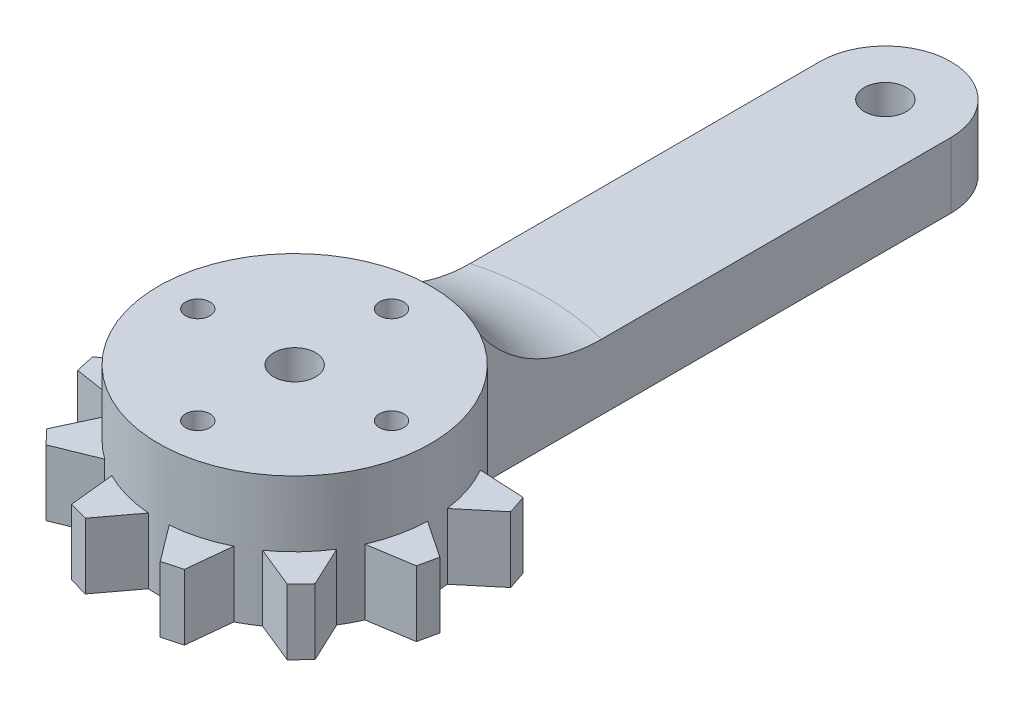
SolidWorks part; units mm, degrees
ref_plane "Front Plane" through (0, 0, 0) normal (0, 0, 1) x (1, 0, 0)
ref_plane "Top Plane" through (0, 0, 0) normal (0, 1, 0) x (1, 0, 0)
ref_plane "Right Plane" through (0, 0, 0) normal (1, 0, 0) x (0, 0, -1)
sketch "Sketch1" plane through (0, 0, 0) normal (0, 1, 0) x (1, 0, 0)
  line L0 (0, 0) -> (0, 45) construction
  line L1 (-5, 0) -> (-5, 45)
  line L2 (5, 0) -> (5, 45)
  circle A0 centre (0, 0) radius 10.38
  arc A1 (-5, 0) -> (5, 0) centre (0, 0) ccw
  arc A2 (5, 45) -> (-5, 45) centre (0, 45) ccw
  circle A3 centre (0, 45) radius 1.6
  circle A4 centre (0, 0) radius 1.6
  point P3 (0, 22.5)
  dimension "D1" = 20.76
  dimension "D4" = 3.2
  dimension "D5" = 3.2
  dimension "D2" = 10
  dimension "D3" = 45
extrude "Boss-Extrude1" add sketch "Sketch1" along normal blind 5
sketch "Sketch2" plane through (0, 5, 0) normal (0, 1, 0) x (1, 0, 0)
  line L0 (-3.5756, -12.8934) -> (-2.7739, -10.0025) construction
  line L1 (-4.2984, -12.6929) -> (-2.8529, -13.0938)
  line L2 (-2.8529, -13.0938) -> (-0.7947, -10.3495)
  line L3 (-4.2984, -12.6929) -> (-4.6492, -9.2806)
  line L4 (0, -2.75) -> (0, 2.75) construction
  arc A0 (-5, 9.0964) -> (5, 9.0964) centre (0, 0) ccw construction
  arc A1 (-4.6492, -9.2806) -> (-0.7947, -10.3495) centre (0, 0) ccw
  point P14 (-3.5756, -12.8934)
  dimension "D1" = 3
  dimension "D2" = 1.5
  dimension "D3" = 4
  dimension "D4" = 15.5
extrude "Boss-Extrude2" add sketch "Sketch2" against normal up to surface (5 mm away)
pattern_circular "CirPattern1" count 5 every 31 about axis through (0, 0, 0) along (0, 1, 0) of "Boss-Extrude2"
sketch "Sketch5" plane through (0, 5, 0) normal (0, 1, 0) x (1, 0, 0)
  circle A0 centre (0, 0) radius 10.38
  circle A3 centre (0, 0) radius 1.6
  circle A4 centre (0, 0) radius 7.38 construction
  circle A5 centre (0, 7.38) radius 0.925
  circle A6 centre (0, -7.38) radius 0.925
  arc A8 (-8.1358, 6.4462) -> (-9.0245, 5.1286) centre (0, 0) ccw construction
  circle A9 centre (-7.38, 0) radius 0.925
  circle A10 centre (7.38, 0) radius 0.925
  dimension "D1" = 1.85
  dimension "D2" = 3
extrude "Boss-Extrude4" add sketch "Sketch5" along normal blind 5
fillet "Fillet1" radius 10 1 edges at (0, 5, -10.38)
